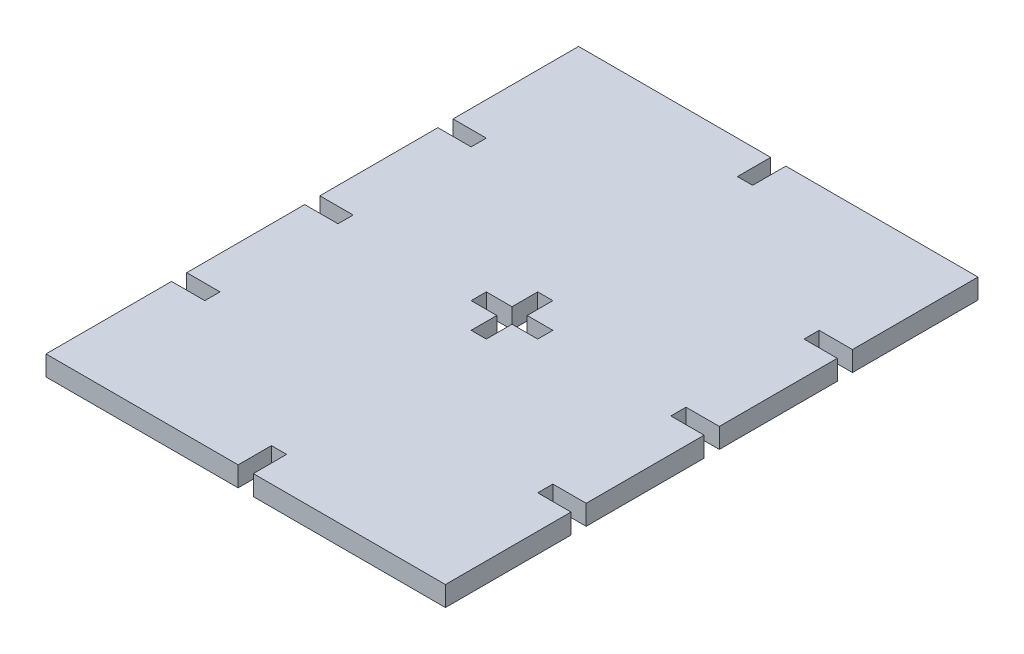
SolidWorks part; units mm, degrees
ref_plane "Alzado" through (0, 0, 0) normal (0, 0, 1) x (1, 0, 0)
ref_plane "Planta" through (0, 0, 0) normal (0, 1, 0) x (1, 0, 0)
ref_plane "Vista lateral" through (0, 0, 0) normal (1, 0, 0) x (0, 0, -1)
sketch "Sketch1" plane through (0, 0, 0) normal (0, 1, 0) x (1, 0, 0)
  line L1 (-30, -40) -> (30, -40)
  line L2 (-30, -40) -> (-30, 40)
  line L3 (-30, 40) -> (30, 40)
  line L4 (30, -40) -> (30, 40)
  line L5 (-30, -40) -> (30, 40) construction
  line L6 (-30, 40) -> (30, -40) construction
  point P0 (0, 0)
extrude "Boss-Extrude1" add sketch "Sketch1" along normal blind 3
sketch "Sketch2" plane through (0, 3, 0) normal (0, 1, 0) x (1, 0, 0)
  line L0 (0, 40) -> (0, -40) construction
  line L1 (30, 40) -> (-30, 40) construction
  line L2 (-30, -40) -> (30, -40) construction
  line L3 (-30, 0) -> (30, 0) construction
  line L4 (-30, 40) -> (-30, -40) construction
  line L5 (30, -40) -> (30, 40) construction
  line L6 (30, 40) -> (30, 0)
  line L7 (-1.14, 45) -> (1.14, 45)
  line L8 (-1.14, 45) -> (-1.14, 35)
  line L9 (-1.14, 35) -> (1.14, 35)
  line L10 (1.14, 45) -> (1.14, 35)
  line L11 (-1.14, 45) -> (1.14, 35) construction
  line L12 (-1.14, 35) -> (1.14, 45) construction
  line L13 (25, 1.14) -> (35, 1.14)
  line L14 (25, 1.14) -> (25, -1.14)
  line L15 (25, -1.14) -> (35, -1.14)
  line L16 (35, 1.14) -> (35, -1.14)
  line L17 (25, 1.14) -> (35, -1.14) construction
  line L18 (25, -1.14) -> (35, 1.14) construction
  line L19 (25, -18.86) -> (35, -18.86)
  line L20 (25, 21.14) -> (35, 21.14)
  line L21 (25, 21.14) -> (25, 18.86)
  line L22 (25, 18.86) -> (35, 18.86)
  line L23 (35, 21.14) -> (35, 18.86)
  line L24 (25, 21.14) -> (35, 18.86) construction
  line L25 (25, 18.86) -> (35, 21.14) construction
  line L26 (35, -21.14) -> (35, -18.86)
  line L27 (25, -21.14) -> (35, -21.14)
  line L28 (25, -21.14) -> (25, -18.86)
  line L29 (-25, -21.14) -> (-25, -18.86)
  line L30 (-25, -21.14) -> (-35, -21.14)
  line L31 (-35, -21.14) -> (-35, -18.86)
  line L32 (-25, -18.86) -> (-35, -18.86)
  line L33 (-25, -1.14) -> (-35, -1.14)
  line L34 (-35, 1.14) -> (-35, -1.14)
  line L35 (-25, 1.14) -> (-35, 1.14)
  line L36 (-25, 1.14) -> (-25, -1.14)
  line L37 (-25, 18.86) -> (-35, 18.86)
  line L38 (-35, 21.14) -> (-35, 18.86)
  line L39 (-25, 21.14) -> (-35, 21.14)
  line L40 (-25, 21.14) -> (-25, 18.86)
  line L41 (-1.14, -35) -> (1.14, -35)
  line L42 (1.14, -45) -> (1.14, -35)
  line L43 (-1.14, -45) -> (1.14, -45)
  line L44 (-1.14, -45) -> (-1.14, -35)
  point P21 (30, 20)
extrude "Cut-Extrude2" cut sketch "Sketch2" against normal blind 3 contours L9 L10 L7 L8 | L15 L16 L13 L14 | L22 L23 L20 L21 | L30 L31 L32 L29 | L27 L26 L19 L28 | L37 L38 L39 L40 | L33 L34 L35 L36 | L42 L41 L44 L43
sketch "Sketch3" plane through (0, 3, 0) normal (0, 1, 0) x (1, 0, 0)
  line L1 (-5, -1.14) -> (5, -1.14)
  line L2 (-5, -1.14) -> (-5, 1.14)
  line L3 (-5, 1.14) -> (5, 1.14)
  line L4 (5, -1.14) -> (5, 1.14)
  line L5 (-5, -1.14) -> (5, 1.14) construction
  line L6 (-5, 1.14) -> (5, -1.14) construction
  line L7 (-1.14, 5) -> (1.14, 5)
  line L8 (-1.14, 5) -> (-1.14, -5)
  line L9 (-1.14, -5) -> (1.14, -5)
  line L10 (1.14, 5) -> (1.14, -5)
  line L11 (-1.14, 5) -> (1.14, -5) construction
  line L12 (-1.14, -5) -> (1.14, 5) construction
  point P0 (0, 0)
  point P6 (0, 0)
extrude "Cut-Extrude4" cut sketch "Sketch3" against normal blind 10 contours L8 L9 L10 L7 | L1 L4 L3 L2
equation "\"la\"= 80mm"
equation "\"an\"= 60mm"
equation "\"D1@Sketch1\"=\"an\""
equation "\"D2@Sketch1\"=\"la\""
equation "\"rl\"= 2.28mm"
equation "\"ra\"= 10mm"
equation "\"D2@Sketch2\"=\"ra\""
equation "\"D1@Sketch2\"=\"rl\""
equation "\"D3@Sketch2\"=\"ra\""
equation "\"D4@Sketch2\"=\"rl\""
equation "\"D5@Sketch2\"=\"ra\""
equation "\"D6@Sketch2\"=\"rl\""
equation "\"D1@Sketch3\"=\"ra\""
equation "\"D2@Sketch3\"=\"rl\""
equation "\"D3@Sketch3\"=\"ra\""
equation "\"D4@Sketch3\"=\"rl\""
